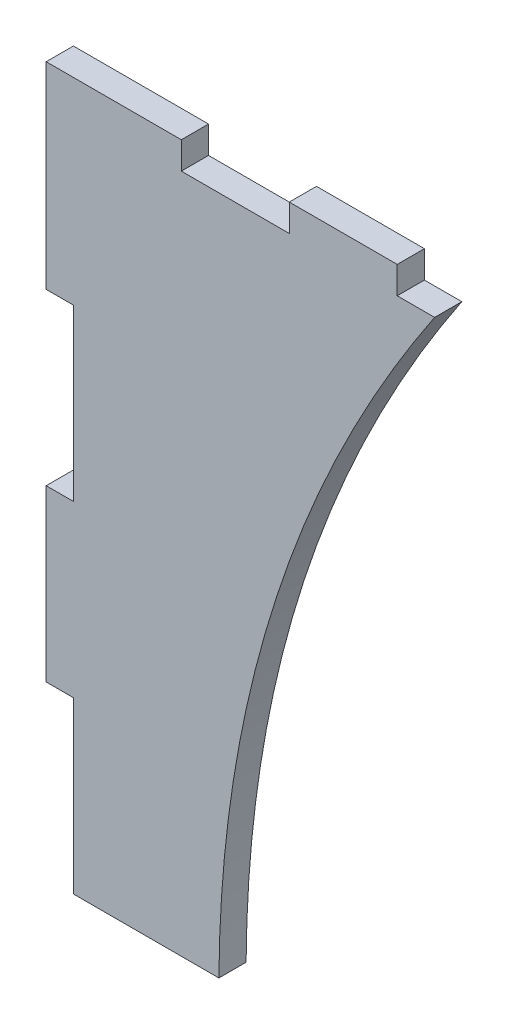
SolidWorks part; units mm, degrees
ref_plane "Front Plane" through (0, 0, 0) normal (0, 0, 1) x (1, 0, 0)
ref_plane "Top Plane" through (0, 0, 0) normal (0, 1, 0) x (1, 0, 0)
ref_plane "Right Plane" through (0, 0, 0) normal (1, 0, 0) x (0, 0, -1)
sketch "Sketch1" plane through (0, 0, 0) normal (0, 0, 1) x (1, 0, 0)
  line L4 (-845.3711, -117.8903) -> (-829.0872, -117.8903)
  line L5 (-850.503, -317.2803) -> (-829.0872, -317.2803)
  line L6 (-839.7951, 97.2092) -> (-839.7951, -317.2803) construction
  line L7 (-845.3711, -18.1953) -> (-845.3711, -117.8903)
  line L8 (-845.3711, -217.5853) -> (-836.8915, -217.5853)
  line L9 (-845.3711, -217.5853) -> (-845.3711, -317.2803)
  line L10 (-845.3711, -317.2803) -> (-829.0872, -317.2803)
  line L11 (-829.0872, -117.8903) -> (-836.8915, -217.5853)
  line L12 (-845.3711, -217.5853) -> (-829.0872, -317.2803) construction
  line L13 (-845.3711, -317.2803) -> (-836.8915, -217.5853) construction
  line L14 (-845.3711, -18.1953) -> (-836.8915, -18.1953)
  line L18 (-836.8915, 82.6436) -> (-836.8915, -18.1953)
  line L22 (-582.8918, 66.0011) -> (-591.9816, 56.1662)
  arc A0 (-735.2915, -317.2803) -> (-591.9816, 56.1662) centre (-178.7635, -316.6268) cw
  point P9 (-839.7951, -251.7233)
sketch "Sketch2" plane through (0, 0, 0) normal (0, 0, 1) x (1, 0, 0)
  line L0 (0, 200) -> (0, 100)
  line L1 (0, 100) -> (16, 100)
  line L2 (16, 300) -> (16, 200)
  line L3 (16, 200) -> (0, 200)
  line L4 (206.5, 416) -> (143, 416)
  line L5 (0, 300) -> (16, 300)
  line L6 (0, 400) -> (0, 416)
  line L7 (16, 100) -> (16, 0)
  line L8 (16, 0) -> (101.6, 0)
  line L9 (16, 300) -> (16, 416) construction
  line L10 (0, 416) -> (16, 416)
  line L11 (79.5, 416) -> (79.5, 400)
  line L13 (143, 400) -> (143, 416)
  line L14 (79.5, 416) -> (16, 416)
  line L15 (206.5, 416) -> (206.5, 400)
  line L16 (0, 300) -> (0, 400)
  line L19 (206.5, 400) -> (228.5, 400)
  line L20 (143, 400) -> (79.5, 400)
  spline S0 degree 2 poles (228.5, 400) (103.2252, 213.7253) (101.6, 0) knots 0 0 0 0.978672 0.978672 0.978672
extrude "Boss-Extrude1" add sketch "Sketch2" along normal blind 16
equation "\"thickness of material\"= 16mm"
equation "\"length\"= 400mm"
equation "\"width\"= 10in"
equation "\"D12@Sketch1\"=\"length\""
equation "\"D13@Sketch1\"=\"length\"/4"
equation "\"D6@Sketch1\"=\"length\""
equation "\"D5@Sketch1\"=\"length\"/4"
equation "\"D2@Sketch2\"=\"thickness of material\""
equation "\"D3@Sketch2\"=\"length\"/4"
equation "\"D4@Sketch2\"=\"length\"/4"
equation "\"D7@Sketch2\"=\"thickness of material\""
equation "\"D8@Sketch2\"=\"thickness of material\""
equation "\"D1@Boss-Extrude1\"=\"thickness of material\""
equation "\"D11@Sketch2\"=\"width\"/4"
equation "\"D12@Sketch2\"=\"width\"/4"
equation "\"D13@Sketch2\"=\"thickness of material\""
